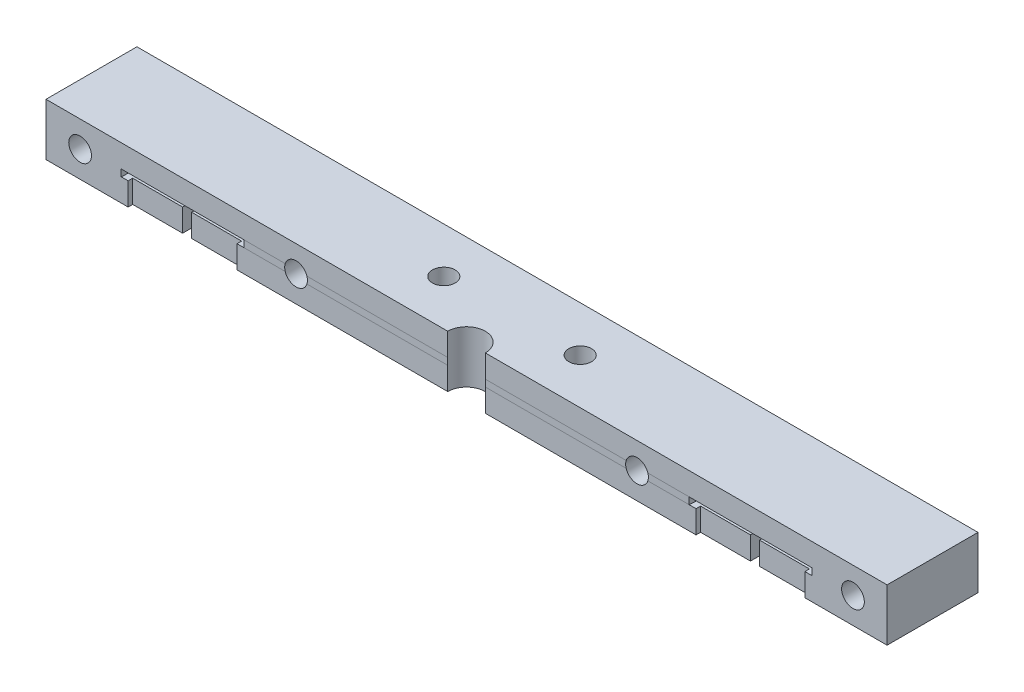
SolidWorks part; units mm, degrees
ref_plane "Front Plane" through (0, 0, 0) normal (0, 0, 1) x (1, 0, 0)
ref_plane "Top Plane" through (0, 0, 0) normal (0, 1, 0) x (1, 0, 0)
ref_plane "Right Plane" through (0, 0, 0) normal (1, 0, 0) x (0, 0, -1)
sketch "Sketch1" plane through (0, 1022.1097, 0) normal (0, -1, 0) x (1, 0, 0)
  line L0 (368.0499, 1286.4871) -> (368.0499, 1285.2171)
  line L1 (368.1769, 1286.4871) -> (368.1769, 1285.3441) construction
  line L2 (368.1769, 1287.6301) -> (368.1769, 1285.3441) construction
  line L3 (368.1769, 1285.3441) -> (382.1152, 1285.3441) construction
  line L4 (382.1152, 1285.3441) -> (382.1152, 1271.4059) construction
  line L5 (382.1152, 1271.4059) -> (384.4012, 1271.4059) construction
  line L6 (384.4012, 1271.4059) -> (384.4012, 1285.3441) construction
  line L7 (384.4012, 1285.3441) -> (398.3394, 1285.3441) construction
  line L8 (398.3394, 1285.3441) -> (398.3394, 1286.4871) construction
  line L9 (398.3394, 1285.3441) -> (398.3394, 1287.6301) construction
  line L10 (398.4664, 1286.4871) -> (462.5757, 1286.488)
  line L11 (368.0499, 1286.4871) -> (345.1007, 1286.4871)
  line L12 (345.1007, 1286.4871) -> (345.1007, 1261.0871)
  line L13 (345.1007, 1261.0871) -> (580.0507, 1261.0871)
  line L14 (462.5757, 1261.0871) -> (462.5757, 1286.488) construction
  line L15 (580.0507, 1286.4871) -> (580.0507, 1261.0871)
  line L16 (557.1014, 1286.4871) -> (580.0507, 1286.4871)
  line L17 (526.6849, 1286.4871) -> (462.5757, 1286.488)
  line L18 (526.8119, 1285.3441) -> (526.8119, 1286.4871) construction
  line L19 (540.7502, 1285.3441) -> (526.8119, 1285.3441) construction
  line L20 (540.7502, 1271.4059) -> (540.7502, 1285.3441) construction
  line L21 (543.0362, 1271.4059) -> (540.7502, 1271.4059) construction
  line L22 (543.0362, 1285.3441) -> (543.0362, 1271.4059) construction
  line L23 (556.9744, 1285.3441) -> (543.0362, 1285.3441) construction
  line L24 (556.9744, 1286.4871) -> (556.9744, 1285.3441) construction
  line L25 (368.0499, 1285.2171) -> (381.9882, 1285.2171)
  line L26 (381.9882, 1285.2171) -> (381.9882, 1271.2789)
  line L27 (381.9882, 1271.2789) -> (384.5282, 1271.2789)
  line L28 (383.2582, 1271.4059) -> (383.2582, 1273.9434) construction
  line L29 (384.5282, 1285.2171) -> (384.5282, 1271.2789)
  line L30 (398.4664, 1286.4871) -> (398.4664, 1285.2171)
  line L31 (398.4664, 1285.2171) -> (384.5282, 1285.2171)
  line L32 (398.3394, 1286.4871) -> (398.4664, 1286.4871) construction
  line L33 (368.0499, 1286.4871) -> (368.1769, 1286.4871) construction
  line L34 (557.1014, 1286.4871) -> (556.9744, 1286.4871) construction
  line L35 (526.8119, 1286.4871) -> (526.6849, 1286.4871) construction
  line L36 (541.8932, 1271.4059) -> (541.8932, 1273.9434) construction
  line L37 (526.8119, 1285.3441) -> (526.8119, 1286.4871) construction
  line L38 (540.7502, 1285.3441) -> (526.8119, 1285.3441) construction
  line L39 (540.7502, 1271.4059) -> (540.7502, 1285.3441) construction
  line L40 (543.0362, 1271.4059) -> (540.7502, 1271.4059) construction
  line L41 (543.0362, 1285.3441) -> (543.0362, 1271.4059) construction
  line L42 (556.9744, 1285.3441) -> (543.0362, 1285.3441) construction
  line L43 (556.9744, 1286.4871) -> (556.9744, 1285.3441) construction
  line L44 (526.6849, 1285.2171) -> (540.6232, 1285.2171)
  line L45 (526.6849, 1286.4871) -> (526.6849, 1285.2171)
  line L46 (540.6232, 1285.2171) -> (540.6232, 1271.2789)
  line L47 (543.1632, 1271.2789) -> (540.6232, 1271.2789)
  line L48 (543.1632, 1285.2171) -> (543.1632, 1271.2789)
  line L49 (557.1014, 1285.2171) -> (543.1632, 1285.2171)
  line L50 (557.1014, 1286.4871) -> (557.1014, 1285.2171)
  point P42 (383.2582, 1271.2789)
  point P54 (541.8932, 1271.2789)
  dimension "D1" = 117.475
  dimension "D2" = 25.4
  dimension "D3" = 0.127
  dimension "D4" = 0.127
  dimension "D5" = 0.127
  dimension "D6" = 0.127
extrude "Boss-Extrude1" add sketch "Sketch1" along normal blind 6.35
sketch "Sketch2" plane through (0, 1022.1097, 0) normal (0, 1, 0) x (1, 0, 0)
  line L0 (408.9757, -1286.4871) -> (357.5407, -1286.4871) construction
  line L1 (366.1132, -1286.4871) -> (345.1007, -1286.4871)
  line L2 (345.1007, -1286.4871) -> (345.1007, -1261.0871)
  line L3 (345.1007, -1261.0871) -> (580.0507, -1261.0871)
  line L4 (345.1007, -1261.0871) -> (580.0507, -1261.0871) construction
  line L5 (462.5757, -1261.0871) -> (462.5757, -1286.488) construction
  line L6 (462.5757, -1286.488) -> (400.4032, -1286.4871)
  line L7 (462.5757, -1286.488) -> (524.7482, -1286.4871)
  line L8 (580.0507, -1286.4871) -> (580.0507, -1261.0871)
  line L9 (559.0382, -1286.4871) -> (580.0507, -1286.4871)
  arc A0 (366.1132, -1286.4871) -> (400.4032, -1286.4871) centre (383.2582, -1286.4871) cw
  circle A1 centre (383.2582, -1286.4871) radius 17.145 construction
  arc A2 (559.0382, -1286.4871) -> (524.7482, -1286.4871) centre (541.8932, -1286.4871) ccw
  dimension "D1" = 17.145
extrude "Boss-Extrude2" add sketch "Sketch2" along normal blind 1.905
sketch "Sketch3" plane through (0, 1024.0147, 0) normal (0, 1, 0) x (1, 0, 0)
  line L2 (345.1007, -1261.0871) -> (345.1007, -1286.4871) construction
  line L3 (580.0507, -1261.0871) -> (345.1007, -1261.0871) construction
  line L4 (345.1007, -1261.0871) -> (580.0507, -1261.0871)
  line L5 (580.0507, -1261.0871) -> (580.0507, -1286.4871)
  line L6 (580.0507, -1286.4871) -> (580.0507, -1261.0871) construction
  line L36 (580.0507, -1286.4871) -> (345.1007, -1286.4871)
  line L37 (345.1007, -1286.4871) -> (366.1132, -1286.4871) construction
  line L38 (345.1007, -1286.4871) -> (345.1007, -1261.0871)
extrude "Boss-Extrude4" add sketch "Sketch3" along normal blind 6.35
sketch "Sketch4" plane through (0, 0, 1261.0871) normal (0, 0, -1) x (-1, 0, 0)
  line L0 (-580.0507, 1023.0622) -> (-345.1007, 1023.0622) construction
  line L1 (-580.0507, 1015.7597) -> (-580.0507, 1030.3647) construction
  line L2 (-345.1007, 1015.7597) -> (-345.1007, 1030.3647) construction
  circle A0 centre (-570.5257, 1023.0622) radius 3.175
  circle A1 centre (-354.6257, 1023.0622) radius 3.175
  dimension "D1" = 6.35
  dimension "D4" = 6.35
  dimension "D2" = 9.525
  dimension "D3" = 9.525
extrude "Cut-Extrude1" cut sketch "Sketch4" against normal through all
sketch "Sketch5" plane through (0, 1015.7597, 0) normal (0, -1, 0) x (1, 0, 0)
  line L0 (462.5757, 1286.488) -> (398.4664, 1286.4871) construction
  line L1 (526.6849, 1286.4871) -> (462.5757, 1286.488) construction
  circle A0 centre (462.5757, 1286.488) radius 5.25
  dimension "D1" = 10.5
extrude "Cut-Extrude2" cut sketch "Sketch5" against normal through all
sketch "Sketch8" plane through (0, 0, 1261.0871) normal (0, 0, -1) x (-1, 0, 0)
  line L1 (-580.0507, 1015.7597) -> (-580.0507, 1030.3647) construction
  line L2 (-580.0507, 1023.0622) -> (-345.1007, 1023.0622) construction
  line L3 (-345.1007, 1015.7597) -> (-345.1007, 1030.3647) construction
  circle A0 centre (-510.2007, 1023.0622) radius 3.175
  circle A1 centre (-414.9507, 1023.0622) radius 3.175
  dimension "D2" = 6.35
  dimension "D4" = 6.35
  dimension "D1" = 69.85
  dimension "D3" = 69.85
extrude "Cut-Extrude4" cut sketch "Sketch8" against normal through all
sketch "Sketch9" plane through (0, 1015.7597, 0) normal (0, -1, 0) x (1, 0, 0)
  circle A0 centre (443.5257, 1273.788) radius 3.175
  circle A1 centre (481.6257, 1273.788) radius 3.175
  dimension "D1" = 6.35
  dimension "D2" = 6.35
extrude "Cut-Extrude5" cut sketch "Sketch9" against normal through all
